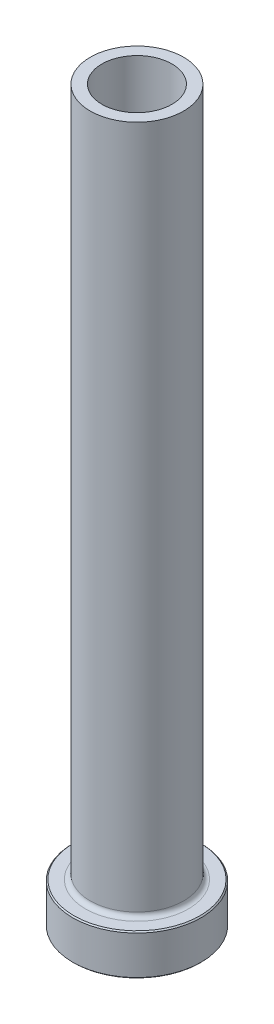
SolidWorks part; units mm, degrees
ref_plane "Front Plane" through (0, 0, 0) normal (0, 0, 1) x (1, 0, 0)
ref_plane "Top Plane" through (0, 0, 0) normal (0, 1, 0) x (1, 0, 0)
ref_plane "Right Plane" through (0, 0, 0) normal (1, 0, 0) x (0, 0, -1)
sketch "Sketch1" plane through (0, 0, 0) normal (0, 0, 1) x (1, 0, 0)
  line L0 (-6, 125) -> (-8, 125)
  line L1 (-8, 125) -> (-8, 7)
  line L2 (-8, 7) -> (-11, 7)
  line L3 (-11, 7) -> (-11, 0)
  line L4 (12.1, 0) -> (-12.1, 0) construction
  line L5 (-11, 0) -> (-6.25, 0)
  line L6 (-6, 70) -> (-6, 125)
  line L7 (0, 92.1877) -> (0, -15.5353) construction
  line L8 (0, -12.1) -> (0, 12.1) construction
  line L9 (-6, 70) -> (-6.25, 58)
  line L10 (-6.25, 58) -> (-6.25, 0)
  dimension "D1" = 0.25
  dimension "ID" = 12
  dimension "OD" = 16
  dimension "L" = 125
  dimension "H" = 22
  dimension "T" = 7
  dimension "N" = 55
  dimension "D2" = 12
revolve "Revolve1" add sketch "Sketch1" angle 360 about L7
fillet "Fillet1" radius 0.8 1 edges at (0, 7, 8)
chamfer "Chamfer1" distance 0.2 angle 45 2 edges at (0, 7, 11) (0, 0, 11)
chamfer "Chamfer3" distance 0.5 angle 45 1 edges at (0, 0, 6.25)
